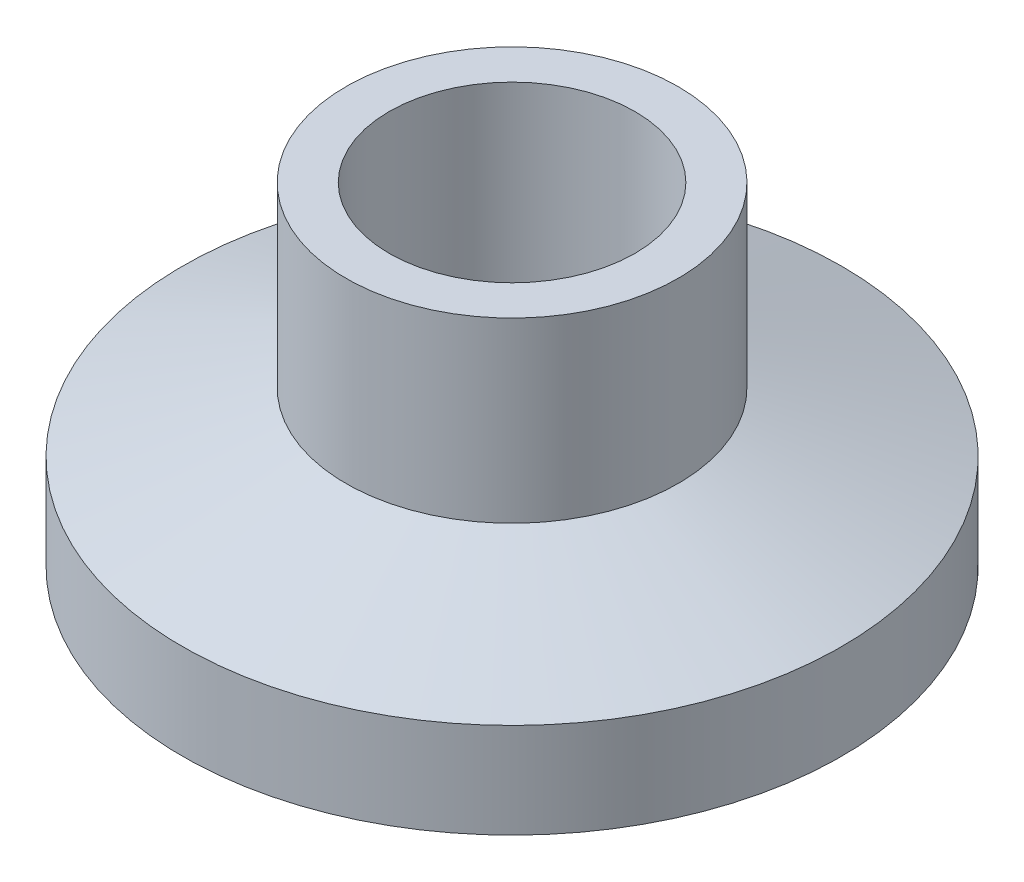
SolidWorks part; units mm, degrees
ref_plane "Front Plane" through (0, 0, 0) normal (0, 0, 1) x (1, 0, 0)
ref_plane "Top Plane" through (0, 0, 0) normal (0, 1, 0) x (1, 0, 0)
ref_plane "Right Plane" through (0, 0, 0) normal (1, 0, 0) x (0, 0, -1)
sketch "Sketch1" plane through (0, 0, 0) normal (0, 0, 1) x (1, 0, 0)
  line L0 (-4.699, 0.889) -> (-4.699, 12.7)
  line L1 (-4.699, 12.7) -> (-6.35, 12.7)
  line L2 (-6.35, 12.7) -> (-6.35, 5.9064)
  line L3 (-6.35, 5.9064) -> (-12.5984, 3.6322)
  line L4 (-12.5984, 3.6322) -> (-12.5984, 0)
  line L5 (-12.5984, 0) -> (-10.922, 0)
  line L6 (-10.922, 0) -> (-10.922, 1.3208)
  line L7 (0, 0) -> (0, 14.3564) construction
  line L9 (-8.6024, 0.889) -> (-4.699, 0.889)
  line L10 (-9.5843, 1.853) -> (-8.6024, 0.889)
  arc A2 (-9.5843, 1.853) -> (-10.922, 1.3208) centre (-10.1473, 1.3208) ccw
  dimension "D7" = 10.1473
  dimension "D1" = 12.7
  dimension "D2" = 3.6322
  dimension "D3" = 110
  dimension "D4" = 4.699
  dimension "D5" = 6.35
  dimension "D6" = 11.811
  dimension "D8" = 10.922
  dimension "D9" = 12.5984
  dimension "D10" = 8.6024
revolve "Revolve1" add sketch "Sketch1" angle 360 about L7
